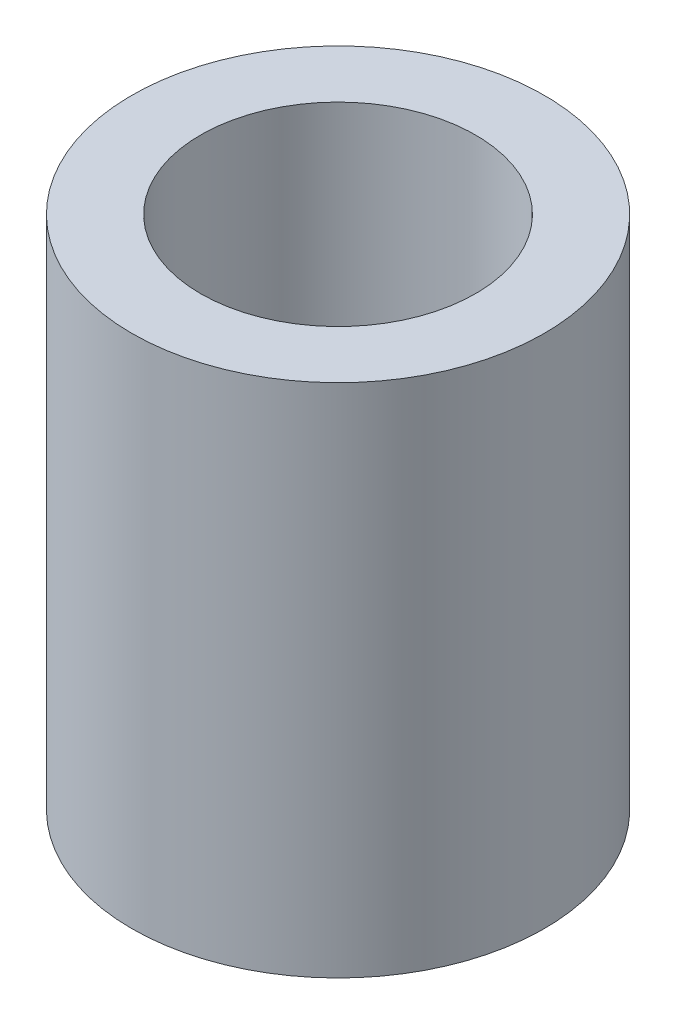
SolidWorks part; units mm, degrees
ref_plane "前视基准面" through (0, 0, 0) normal (0, 0, 1) x (1, 0, 0)
ref_plane "上视基准面" through (0, 0, 0) normal (0, 1, 0) x (1, 0, 0)
ref_plane "右视基准面" through (0, 0, 0) normal (1, 0, 0) x (0, 0, -1)
sketch "草图1" plane through (0, 0, 0) normal (0, 1, 0) x (1, 0, 0)
  circle A0 centre (0, 0) radius 30
  circle A1 centre (0, 0) radius 20
  dimension "D1" = 60
  dimension "D2" = 40
extrude "拉伸1" add sketch "草图1" along normal blind 75
